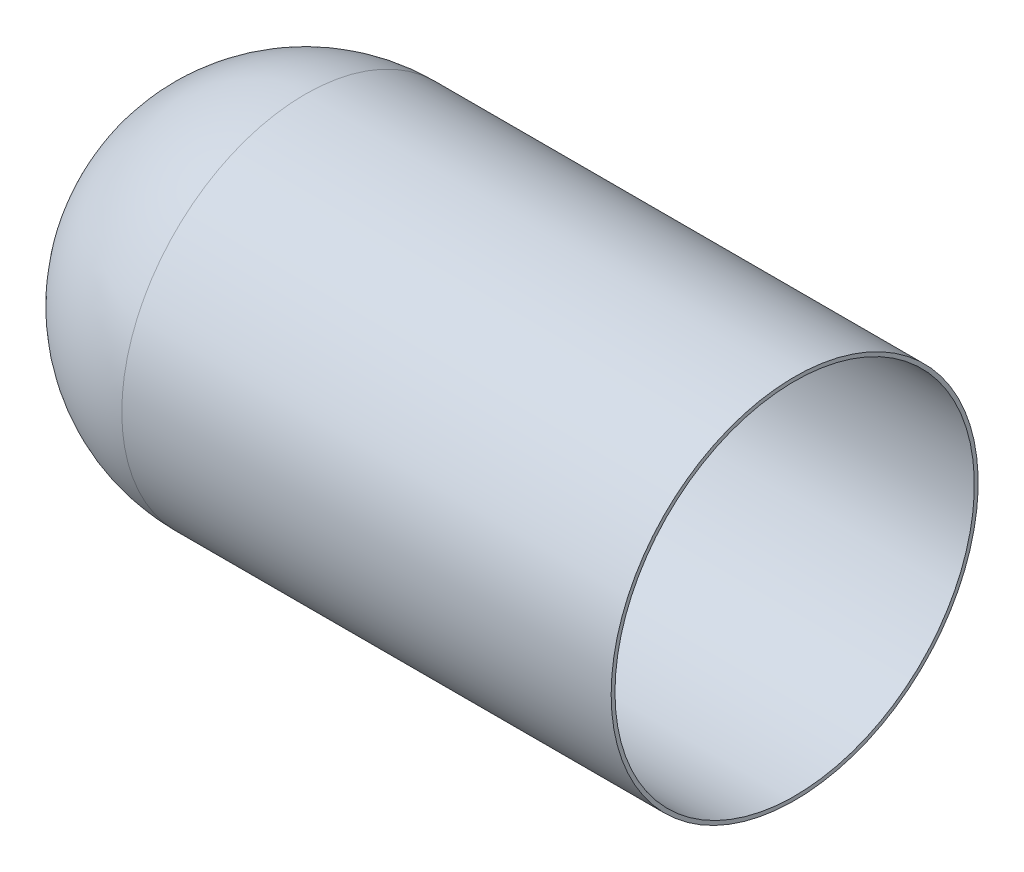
SolidWorks part; units mm, degrees
ref_plane "Front" through (0, 0, 0) normal (0, 0, 1) x (1, 0, 0)
ref_plane "Top" through (0, 0, 0) normal (0, 1, 0) x (1, 0, 0)
ref_plane "Right" through (0, 0, 0) normal (1, 0, 0) x (0, 0, -1)
sketch "Sketch1" plane through (0, 0, 0) normal (0, 0, 1) x (1, 0, 0)
  line L0 (0, 0) -> (68.5511, 0) construction
  line L1 (0, 149.225) -> (-406.4, 149.225)
  line L2 (-542.1464, 0) -> (-542.1464, 61.976) construction
  line L3 (0, 152.4) -> (-406.4, 152.4)
  line L4 (-545.3214, 0) -> (-545.3214, 62.6627) construction
  line L5 (0, 152.4) -> (0, 149.225)
  line L6 (-542.1464, 0) -> (-545.3214, 0) construction
  line L7 (-555.625, 0) -> (-558.8, 0)
  arc A0 (-406.4, 149.225) -> (-542.1464, 61.976) centre (-406.4, 0) ccw
  arc A1 (-406.4, 152.4) -> (-545.3214, 62.6627) centre (-406.4, 0) ccw
  arc A2 (-542.1464, 61.976) -> (-555.625, 0) centre (-406.4, 0) ccw
  arc A3 (-545.3214, 62.6627) -> (-558.8, 0) centre (-406.4, 0) ccw
  dimension "D3" = 152.4
  dimension "D5" = 149.225
  dimension "D1" = 61.976
  dimension "D2" = 406.4
  dimension "D4" = 545.3214
  dimension "D6" = 3.175
  dimension "D7" = 558.8
revolve "Revolve1" add sketch "Sketch1" angle 360 about L0
sketch "Sketch2" plane through (0, 0, 0) normal (0, 1, 0) x (1, 0, 0)
  line L0 (-406.4, -152.4) -> (-406.4, 152.4) construction
  line L1 (-511.1343, 88.9) -> (-355.6, 124.8079)
  line L2 (-355.6, 124.8079) -> (-143.6715, 257.2355)
  line L3 (-143.6715, 257.2355) -> (-530.1843, 257.2355)
  line L4 (-530.1843, 88.9) -> (-530.1843, 257.2355)
  line L5 (0, 152.4) -> (-406.4, 152.4) construction
  line L6 (-511.1343, 88.9) -> (-530.1843, 88.9)
  arc A1 (-406.4, 152.4) -> (-406.4, -152.4) centre (-406.4, 0) ccw construction
  dimension "D1" = 32
  dimension "D2" = 13
  dimension "D3" = 50.8
  dimension "D4" = 88.9
  dimension "D5" = 19.05
extrude "CTD Cut" [suppressed] cut sketch "Sketch2" against normal mid plane 30.353
sketch "Sketch3" plane through (0, 0, 0) normal (0, 1, 0) x (1, 0, 0)
  line L0 (-406.4, -152.4) -> (-406.4, 152.4) construction
  line L1 (-355.6, -124.8079) -> (-511.1343, -88.9)
  line L2 (-355.6, -124.8079) -> (-96.9627, -286.4224)
  line L3 (-96.9627, -286.4224) -> (-530.1843, -286.4224)
  line L4 (-530.1843, -286.4224) -> (-530.1843, -88.9)
  line L6 (-406.4, -152.4) -> (0, -152.4) construction
  line L7 (-511.1343, -88.9) -> (-530.1843, -88.9)
  arc A0 (-406.4, 152.4) -> (-406.4, -152.4) centre (-406.4, 0) ccw construction
  dimension "D1" = 13
  dimension "D2" = 88.9
  dimension "D3" = 19.05
  dimension "D4" = 32
  dimension "D5" = 50.8
extrude "D.O. Cut" [suppressed] cut sketch "Sketch3" against normal mid plane 30.353
sketch "Sketch4" plane through (0, 0, 0) normal (0, 1, 0) x (1, 0, 0)
  circle A0 centre (-90.4748, 0) radius 31.5214
  dimension "D1" = 63.0428
  dimension "D2" = 90.4748
extrude "Extrude1" [suppressed] cut sketch "Sketch4" against normal through all
sketch "Sketch7" plane through (0, 0, 0) normal (0, 0, 1) x (1, 0, 0)
  line L5 (-546.1, 52.4596) -> (-546.1, 0)
  line L6 (-555.625, 0) -> (-546.1, 0)
  line L7 (0, 0) -> (-92.5978, 0) construction
  arc A2 (-406.4, 149.225) -> (-406.4, -149.225) centre (-406.4, 0) ccw construction
  arc A3 (-546.1, 52.4596) -> (-555.625, 0) centre (-406.4, 0) ccw
  dimension "D1" = 546.1
  dimension "D2" = 9.525
  dimension "D3" = 104.9192
revolve "Revolve2" add sketch "Sketch7" angle 360 about L7
sketch3d "CenterOfMass 10/16/2008 11:35:31"
  point P0 (-145.7653, 1.7813, 1.7895)
sketch "Sketch9" plane through (0, 0, 0) normal (0, 1, 0) x (1, 0, 0)
  line L0 (0, 0) -> (-406.4, 0) construction
  circle A0 centre (-91.1358, 0) radius 32.9406
  dimension "D1" = 65.8813
extrude "ClearanceCut" [suppressed] cut sketch "Sketch9" against normal through all
sketch "Sketch10" plane through (0, 0, 0) normal (1, 0, 0) x (0, 0, -1)
  circle A0 centre (0, 0) radius 41.275
  dimension "D1" = 82.55
extrude "Extrude2" [suppressed] cut sketch "Sketch10" against normal through all
equation "\"Buoyancy\"=\"SW-Volume\"*(\"SW-Density\"-.037062)"
